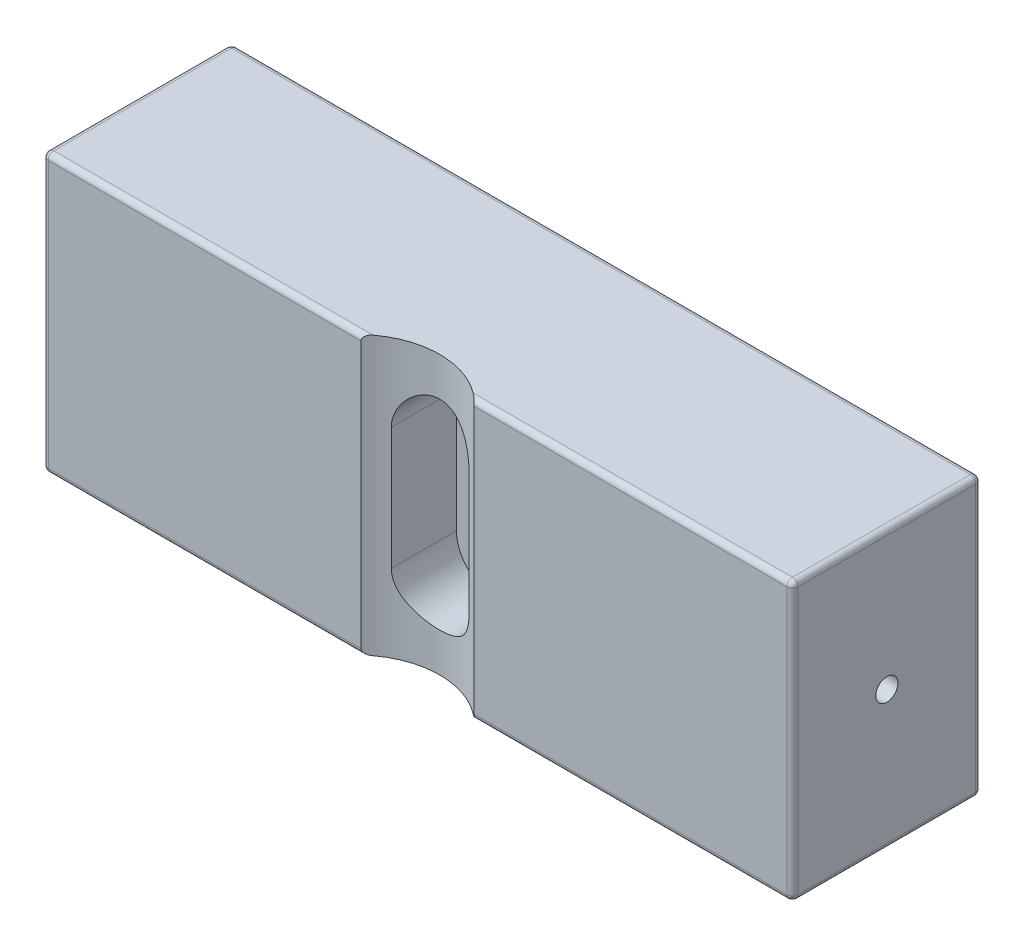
SolidWorks part; units mm, degrees
ref_plane "Alzado" through (0, 0, 0) normal (0, 0, 1) x (1, 0, 0)
ref_plane "Planta" through (0, 0, 0) normal (0, 1, 0) x (1, 0, 0)
ref_plane "Vista lateral" through (0, 0, 0) normal (1, 0, 0) x (0, 0, -1)
sketch "Croquis1" plane through (0, 0, 0) normal (0, 0, 1) x (1, 0, 0)
  line L1 (-67.5, -25) -> (67.5, -25)
  line L2 (-67.5, -25) -> (-67.5, 25)
  line L3 (-67.5, 25) -> (67.5, 25)
  line L4 (67.5, -25) -> (67.5, 25)
  line L5 (-67.5, -25) -> (67.5, 25) construction
  line L6 (-67.5, 25) -> (67.5, -25) construction
  point P0 (0, 0)
  dimension "D1" = 135
  dimension "D2" = 50
extrude "Saliente-Extruir1" add sketch "Croquis1" along normal blind 34
sketch "Croquis2" plane through (0, 25, 0) normal (0, 1, 0) x (1, 0, 0)
  circle A0 centre (0, -45) radius 15
  dimension "D1" = 30
  dimension "D2" = 45
extrude "Cortar-Extruir1" cut sketch "Croquis2" against normal up to surface (50 mm away)
sketch "Croquis3" plane through (0, 0, 34) normal (0, 0, 1) x (1, 0, 0)
  line L0 (0, -11) -> (0, 11) construction
  line L1 (-7, -11) -> (-7, 11)
  line L2 (7, -11) -> (7, 11)
  arc A0 (-7, -11) -> (7, -11) centre (0, -11) ccw
  arc A1 (7, 11) -> (-7, 11) centre (0, 11) ccw
  point P2 (0, 0)
  dimension "D2" = 7
  dimension "D1" = 22
extrude "Cortar-Extruir2" cut sketch "Croquis3" against normal blind 14
sketch "Croquis4" plane through (67.5, 0, 0) normal (1, 0, 0) x (0, 0, -1)
  line L0 (0, -25) -> (0, 25) construction
  line L1 (-34, -25) -> (0, -25) construction
  circle A0 centre (-17, 75) radius 2
  dimension "D1" = 4
  dimension "D2" = 17
  dimension "D3" = 100
sketch "Croquis5" plane through (-67.5, 0, 0) normal (-1, 0, 0) x (0, 0, 1)
  circle A0 centre (17, 0) radius 2
  dimension "D1" = 17
extrude "Cortar-Extruir4" cut sketch "Croquis5" against normal blind 10
mirror "Simetría1" about plane through (0, 0, 0) normal (1, 0, 0) of "Cortar-Extruir4"
fillet "Redondeo1" radius 1 14 edges at (67.5, 0, 0) (0, 25, 0) (0, -25, 0) (67.5, 0, 34) (-38.849, 25, 34) (38.849, 25, 34) (-67.5, 0, 34) (38.849, -25, 34) (-38.849, -25, 34) (67.5, -25, 17) (-67.5, -25, 17) (-67.5, 25, 17) (67.5, 25, 17) (-67.5, 0, 0)
